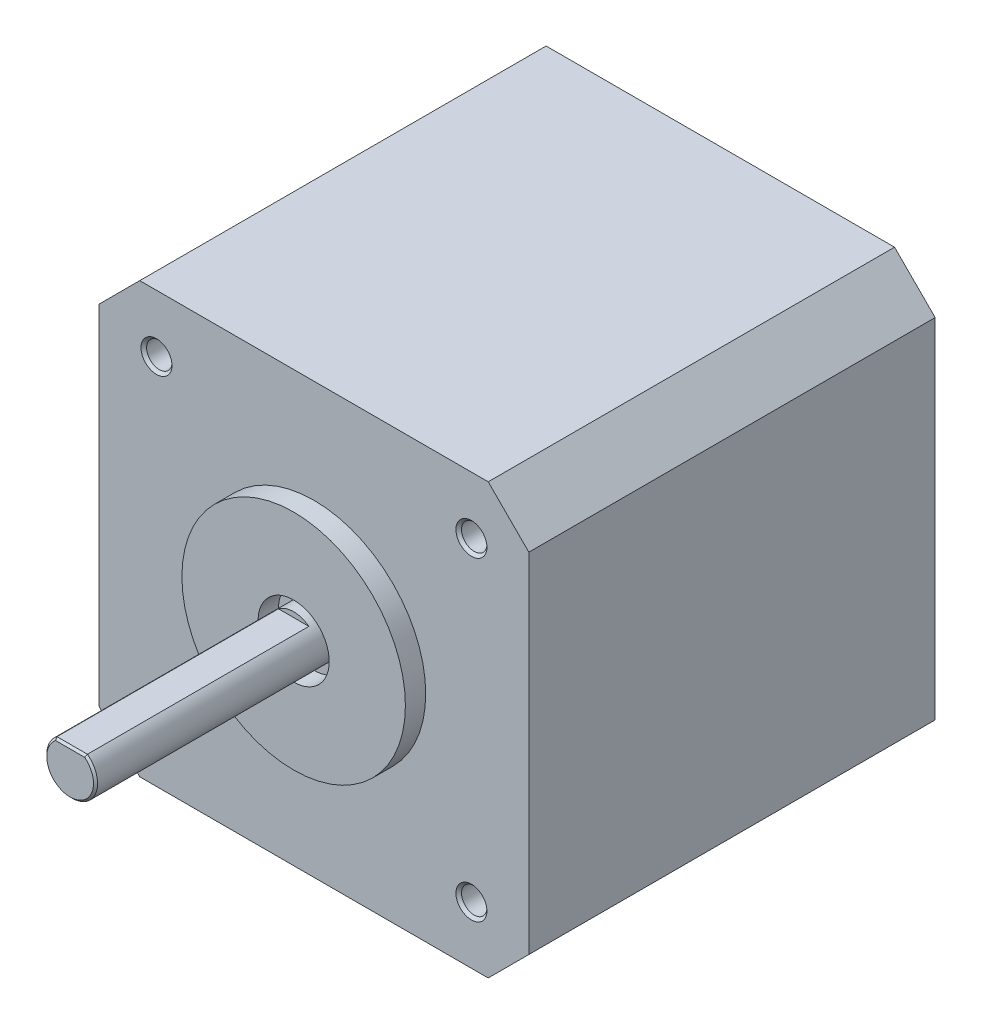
SolidWorks part; units mm, degrees
ref_plane "Piano frontale" through (0, 0, 0) normal (0, 0, 1) x (1, 0, 0)
ref_plane "Piano superiore" through (0, 0, 0) normal (0, 1, 0) x (1, 0, 0)
ref_plane "Piano destro" through (0, 0, 0) normal (1, 0, 0) x (0, 0, -1)
sketch "Schizzo1" plane through (0, 0, 0) normal (0, 0, 1) x (1, 0, 0)
  line L1 (-21.15, 21.15) -> (21.15, 21.15)
  line L2 (-21.15, 21.15) -> (-21.15, -21.15)
  line L3 (-21.15, -21.15) -> (21.15, -21.15)
  line L4 (21.15, 21.15) -> (21.15, -21.15)
  line L5 (-21.15, 21.15) -> (21.15, -21.15) construction
  line L6 (-21.15, -21.15) -> (21.15, 21.15) construction
  point P0 (0, 0)
  dimension "D1" = 42.3
  dimension "D2" = 42.3
extrude "Estrusione-Estrusione1" add sketch "Schizzo1" along normal blind 40
fillet "Raccordo1" [suppressed] radius 5
sketch "Schizzo2" plane through (0, 0, 40) normal (0, 0, 1) x (1, 0, 0)
  circle A0 centre (0, 0) radius 11
  dimension "D1" = 22
extrude "Estrusione-Estrusione2" add sketch "Schizzo2" along normal blind 2
sketch "Schizzo3" plane through (0, 0, 42) normal (0, 0, 1) x (1, 0, 0)
  circle A0 centre (0, 0) radius 3.5
  dimension "D1" = 7
extrude "Taglio-Estrusione1" cut sketch "Schizzo3" against normal blind 2
sketch "Schizzo4" plane through (0, 0, 40) normal (0, 0, 1) x (1, 0, 0)
  circle A0 centre (0, 0) radius 2.5
  dimension "D1" = 5
extrude "Estrusione-Estrusione3" add sketch "Schizzo4" along normal blind 24
sketch "Schizzo5" plane through (0, 0, 64) normal (0, 0, 1) x (1, 0, 0)
  line L0 (0, 0) -> (0, 4.0436) construction
  line L2 (-2.5, 3) -> (2.5, 3)
  line L3 (-2.5, 3) -> (-2.5, 2)
  line L4 (-2.5, 2) -> (2.5, 2)
  line L5 (2.5, 3) -> (2.5, 2)
  line L6 (-2.5, 3) -> (2.5, 2) construction
  line L7 (-2.5, 2) -> (2.5, 3) construction
  circle A0 centre (0, 0) radius 2.5 construction
  point P3 (0, 2.5)
  dimension "D1" = 5
  dimension "D2" = 1
extrude "Taglio-Estrusione2" cut sketch "Schizzo5" against normal blind 22
sketch "Schizzo6" plane through (0, 0, 40) normal (0, 0, 1) x (1, 0, 0)
  line L0 (0, 21.7379) -> (0, -23.0357) construction
  line L1 (-29.2002, 0) -> (26.6636, 0) construction
  circle A0 centre (15.5, 15.5) radius 1.5
  circle A1 centre (-15.5, 15.5) radius 1.5
  circle A2 centre (15.5, -15.5) radius 1.5
  circle A3 centre (-15.5, -15.5) radius 1.5
hole_wizard "Foro filettato M3-1" positions "Schizzo7" profile "Schizzo9" tap size "M3" standard "ISO"
sketch "Schizzo7" plane through (0, 0, 40) normal (0, 0, 1) x (1, 0, 0)
  point P0 (15.5, 15.5)
  point P3 (-15.5, 15.5)
  point P6 (-15.5, -15.5)
  point P9 (15.5, -15.5)
sketch "Schizzo9" plane through (15.5, 15.5, 40) normal (1, 0, 0) x (0, -1, 0)
  line L0 (0, 0) -> (0, 9.2511)
  line L1 (0, 9.2511) -> (1.25, 8.5)
  line L2 (1.25, 8.5) -> (1.25, 0.275)
  line L3 (1.25, 0.275) -> (1.525, 0)
  line L5 (1.525, 0) -> (0, 0)
  line L6 (-1.25, 0.275) -> (-1.525, 0) construction
  line L10 (0, 9.2511) -> (-1.25, 8.5) construction
  line L11 (0, -6.35) -> (0, 107.95) construction
  dimension "Tap Drill Dia." = 2.5
  dimension "Tap Drill Depth" = 8.5
  dimension "Near C'Sink Dia." = 3.05
  dimension "Near C'Sink Angle" = 90
  dimension "Drill Angle" = 118
chamfer "Smusso1" distance 0.2 angle 45 2 edges at (0, -2.5, 64) (0, 2, 64)
chamfer "Smusso2" distance 4 angle 45 4 edges at (21.15, -21.15, 20) (21.15, 21.15, 20) (-21.15, -21.15, 20) (-21.15, 21.15, 20)
equation "\"D2@Schizzo6\"=31/2"
equation "\"D3@Schizzo6\"=31/2"
